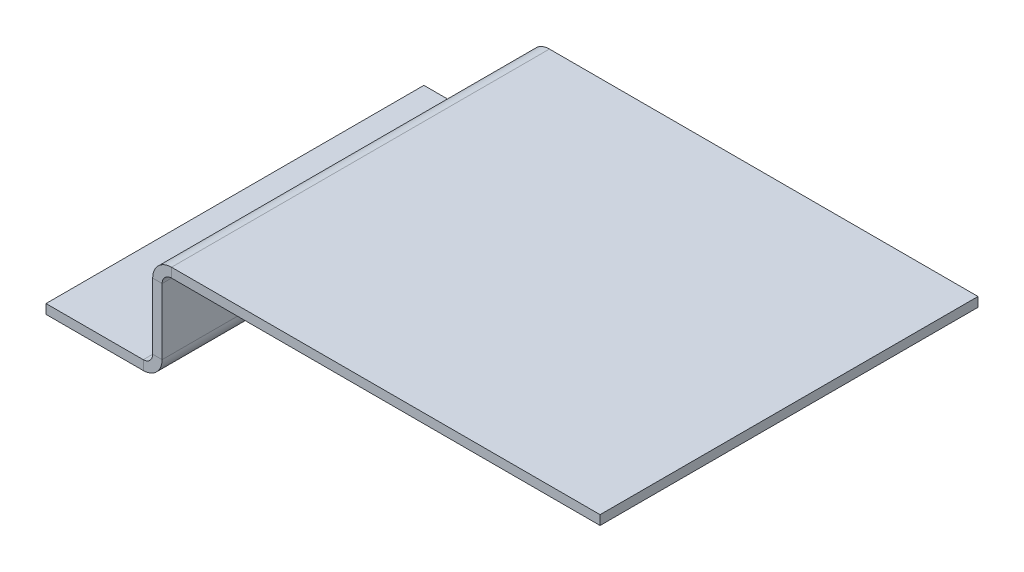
SolidWorks part; units mm, degrees
ref_plane "Front" through (0, 0, 0) normal (0, 0, 1) x (1, 0, 0)
ref_plane "Top" through (0, 0, 0) normal (0, 1, 0) x (1, 0, 0)
ref_plane "Right" through (0, 0, 0) normal (1, 0, 0) x (0, 0, -1)
sketch "Sketch1" plane through (0, 0, 0) normal (0, 1, 0) x (1, 0, 0)
  line L1 (0, 0) -> (117.6323, 0)
  line L2 (0, 0) -> (0, 80.2293)
  line L3 (0, 80.2293) -> (117.6323, 80.2293)
  line L4 (117.6323, 0) -> (117.6323, 80.2293)
sheet metal parameters "Sheet-Metal1" thickness 2 parameters "D1"=2
base flange "Base-Flange1" sketch "Sketch1" thickness 2 reverse thickness direction yes parameters "D1"=2
sketch "Sketch19" plane through (0, 2, 0) normal (0, 1, 0) x (-1, 0, 0)
  line L0 (-23.0075, -60.3579) -> (-23.0075, -21.2984)
jog "Jog2" parameters "D1"=2
bend "JogBend1" bend radius 2 bend angle 90 parameters "D5"=1
bend "JogBend2" bend radius 2 bend angle 90 parameters "D5"=2
break corner "Break-Corner1" [suppressed] thickness 2 parameters "D1"=5, "D7"=5
flat pattern "Flat-Pattern1"
sketch "Bend-Lines1" plane through (0, 2, 0) normal (0, 1, 0) x (-1, 0, 0)
  line L0 (-41.7199, -80.2293) -> (-41.7199, 0) construction
  line L1 (-23.0075, -80.2293) -> (-23.0075, 0) construction
  line L2 (-41.7199, -80.2293) -> (-41.7199, 0) construction
  line L3 (-23.0075, -80.2293) -> (-23.0075, 0) construction
bend of the flat pattern "Flatten-<JogBend1>1"
bend of the flat pattern "Flatten-<JogBend2>1"
break corner "Corner-Trim1" [suppressed] thickness 2 parameters "D1"=5, "D7"=5
